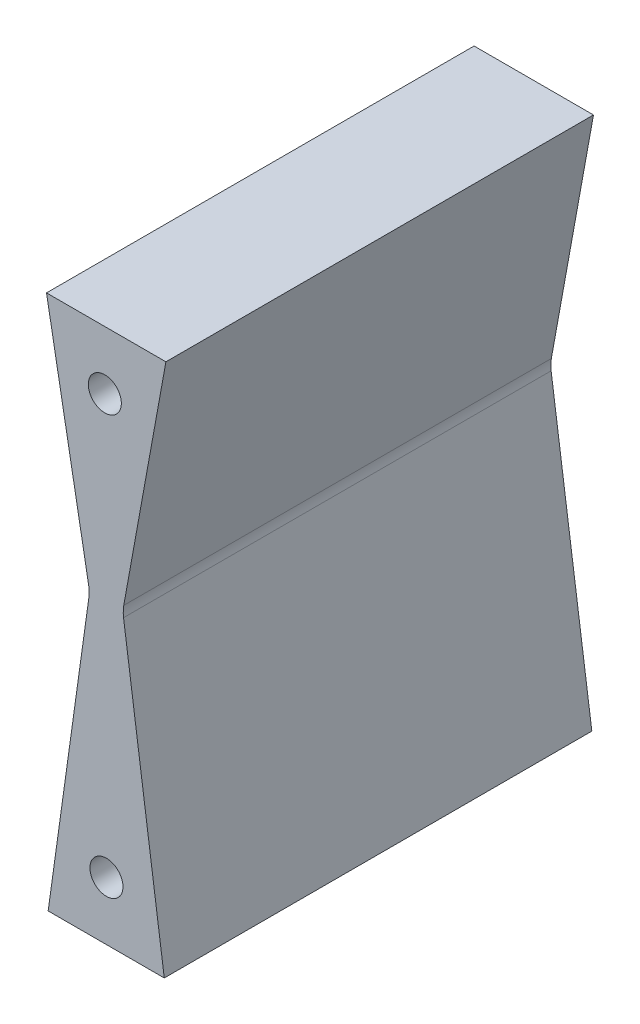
SolidWorks part; units mm, degrees
ref_plane "Frontal" through (0, 0, 0) normal (0, 0, 1) x (1, 0, 0)
ref_plane "Horizontal" through (0, 0, 0) normal (0, 1, 0) x (1, 0, 0)
ref_plane "Profil" through (0, 0, 0) normal (1, 0, 0) x (0, 0, -1)
sketch "Esquisse1" plane through (0, 0, 0) normal (0, 0, 1) x (1, 0, 0)
  line L0 (-40.5517, -157.5) -> (-48.9328, -97.4679) construction
  line L1 (-64.4483, -157.5) -> (-40.5517, -157.5) construction
  line L2 (-56.0672, -97.4679) -> (-64.4483, -157.5) construction
  line L3 (-64.7867, -47.5) -> (-56.1127, -95.2489) construction
  line L4 (-40.2133, -47.5) -> (-64.7867, -47.5) construction
  line L5 (-48.8873, -95.2489) -> (-40.2133, -47.5) construction
  line L6 (-40.5517, -157.5) -> (-48.9328, -97.4679)
  line L7 (-64.4483, -157.5) -> (-40.5517, -157.5)
  line L8 (-56.0672, -97.4679) -> (-64.4483, -157.5)
  line L9 (-64.7867, -47.5) -> (-56.1127, -95.2489)
  line L10 (-40.2133, -47.5) -> (-64.7867, -47.5)
  line L11 (-48.8873, -95.2489) -> (-40.2133, -47.5)
  arc A0 (-48.8873, -95.2489) -> (-48.9328, -97.4679) centre (-42, -96.5) ccw construction
  arc A1 (-56.0672, -97.4679) -> (-56.1127, -95.2489) centre (-63, -96.5) ccw construction
  arc A2 (-48.8873, -95.2489) -> (-48.9328, -97.4679) centre (-42, -96.5) ccw
  arc A3 (-56.0672, -97.4679) -> (-56.1127, -95.2489) centre (-63, -96.5) ccw
extrude "Base-Extrusion" add sketch "Esquisse1" against normal blind 88
hole_wizard "Trou taraudé M8x1.251" positions "Esquisse3" profile "Esquisse2" tap size "M8x1.25" standard "Ansi Métrique"
sketch "Esquisse3" plane through (0, 0, 0) normal (0, 0, 1) x (1, 0, 0)
  line L0 (-40.2133, -47.5) -> (-64.7867, -47.5) construction
  line L1 (-64.4483, -157.5) -> (-40.5517, -157.5) construction
  point P0 (-52.7867, -59.5)
  point P1 (-52.4483, -145.5)
  dimension "D1" = 12
  dimension "D2" = 12
  dimension "D3" = 12
  dimension "D4" = 12
sketch "Esquisse2" plane through (-52.7867, -59.5, 0) normal (1, 0, 0) x (0, -1, 0)
  line L0 (0, 0) -> (0, 32.0429)
  line L1 (0, 32.0429) -> (3.4, 30)
  line L2 (3.4, 30) -> (3.4, 0)
  line L5 (3.4, 0) -> (0, 0)
  line L10 (0, 32.0429) -> (-3.4, 30) construction
  line L11 (0, -6.35) -> (0, 107.95) construction
  dimension "Diamètre du perçage" = 6.8
  dimension "Profondeur du perçage" = 30
  dimension "Angle de pointe" = 118
